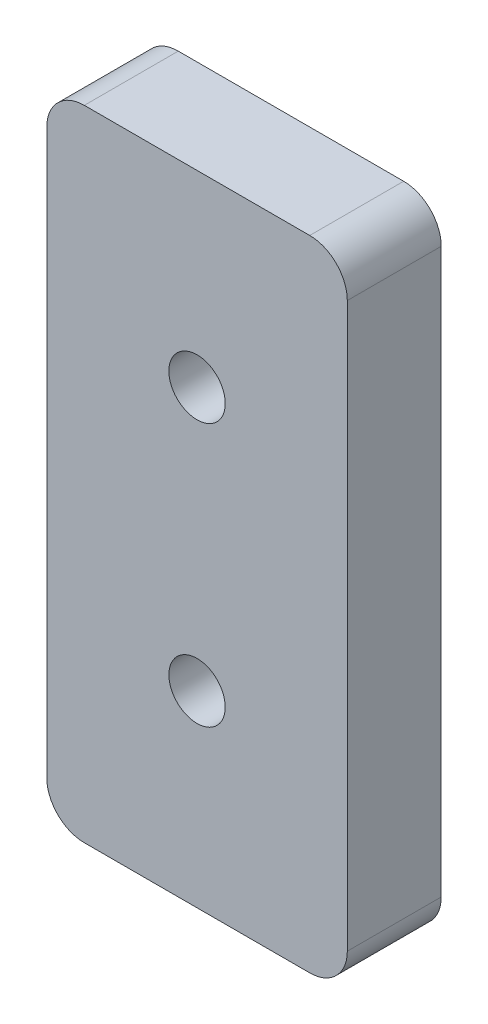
SolidWorks part; units mm, degrees
ref_plane "Plan de face" through (0, 0, 0) normal (0, 0, 1) x (1, 0, 0)
ref_plane "Plan de dessus" through (0, 0, 0) normal (0, 1, 0) x (1, 0, 0)
ref_plane "Plan de droite" through (0, 0, 0) normal (1, 0, 0) x (0, 0, -1)
sketch "Esquisse1" plane through (0, 0, 0) normal (0, 0, 1) x (1, 0, 0)
  line L0 (0, 17) -> (0, 0) construction
  line L1 (-8, -17) -> (8, -17)
  line L2 (-8, -17) -> (-8, 17)
  line L3 (-8, 17) -> (8, 17)
  line L4 (8, -17) -> (8, 17)
  line L5 (-8, 0) -> (8, 0) construction
  circle A0 centre (0, -7) radius 1.5
  circle A1 centre (0, 7) radius 1.5
  dimension "D2" = 3
  dimension "D1" = 14
  dimension "D3" = 10
  dimension "D4" = 16
extrude "Boss.-Extru.1" add sketch "Esquisse1" along normal blind 5
fillet "Congé1" radius 2 4 edges at (8, -17, 2.5) (-8, -17, 2.5) (-8, 17, 2.5) (8, 17, 2.5)
